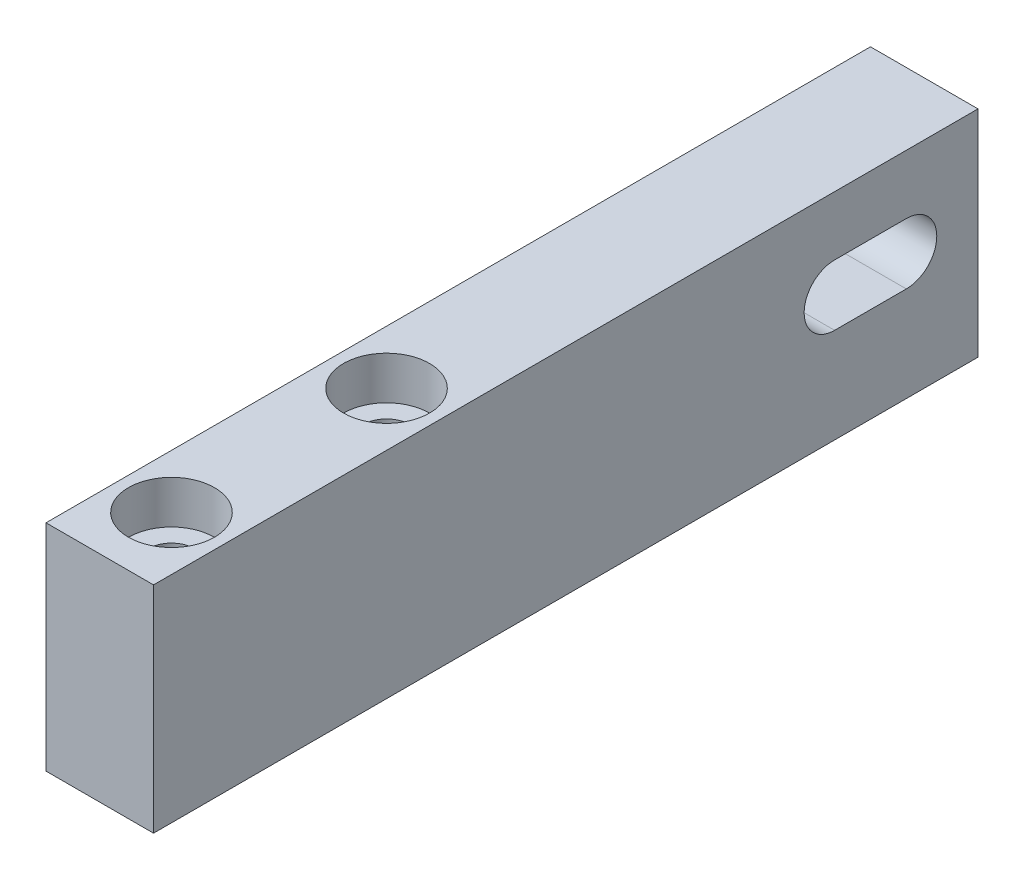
SolidWorks part; units mm, degrees
ref_plane "Plan de face" through (0, 0, 0) normal (0, 0, 1) x (1, 0, 0)
ref_plane "Plan de dessus" through (0, 0, 0) normal (0, 1, 0) x (1, 0, 0)
ref_plane "Plan de droite" through (0, 0, 0) normal (1, 0, 0) x (0, 0, -1)
sketch "Esquisse1" plane through (0, 0, 0) normal (0, 0, 1) x (1, 0, 0)
  line L1 (0, 0) -> (15, 0)
  line L2 (0, 0) -> (0, 30)
  line L3 (0, 30) -> (15, 30)
  line L4 (15, 0) -> (15, 30)
  dimension "D1" = 15
  dimension "D2" = 30
extrude "Extrusion1" add sketch "Esquisse1" against normal blind 115
hole_wizard "Chambrage pour axes 6.5 mm1" positions "Esquisse3" profile "Esquisse2" counterbore size "6.5" standard "HASCO Métrique"
sketch "Esquisse3" plane through (-0.362, 30, -44.3215) normal (0, -1, 0) x (1, 0, 0)
  line L0 (0.362, 44.3215) -> (15.362, 44.3215) construction
  line L1 (0.362, -70.6785) -> (0.362, 44.3215) construction
  point P0 (7.862, 4.3215)
  point P1 (7.862, 34.3215)
  dimension "D1" = 10
  dimension "D2" = 7.5
  dimension "D3" = 30
sketch "Esquisse2" plane through (7.5, 30, -40) normal (1, 0, 0) x (0, 0, 1)
  line L0 (0, 0) -> (0, 30)
  line L1 (0, 30) -> (3.25, 30)
  line L3 (3.25, 30) -> (3.25, 6)
  line L4 (3.25, 6) -> (6, 6)
  line L5 (6, 6) -> (6, 0)
  line L7 (6, 0) -> (0, 0)
  line L11 (0, -6.35) -> (0, 107.95) construction
  dimension "Diamètre du perçage jusqu'au prochain" = 6.5
  dimension "Profondeur du perçage jusqu'au prochain" = 30
  dimension "Diamètre du chambrage" = 12
  dimension "Profondeur du chambrage" = 6
sketch "Esquisse4" plane through (0, 0, 0) normal (-1, 0, 0) x (0, 0, 1)
  line L0 (-105, 17.5) -> (-95, 17.5) construction
  line L1 (-115, 0) -> (0, 0) construction
  line L2 (-105, 13.25) -> (-95, 13.25)
  line L3 (-105, 21.75) -> (-95, 21.75)
  line L4 (-115, 30) -> (-115, 0) construction
  circle A0 centre (-100, 17.5) radius 4.25 construction
  arc A1 (-105, 13.25) -> (-105, 21.75) centre (-105, 17.5) cw
  arc A2 (-95, 13.25) -> (-95, 21.75) centre (-95, 17.5) ccw
  dimension "D1" = 17.5
  dimension "D4" = 15
  dimension "D5" = 10
  dimension "D2" = 4.25
  dimension "D3" = 4.25
extrude "Enlèv. mat.-Extru.1" cut sketch "Esquisse4" against normal up to next
ref_plane "Plan1" through (0, 17.5, 0) normal (0, 1, 0) x (-1, 0, 0)
